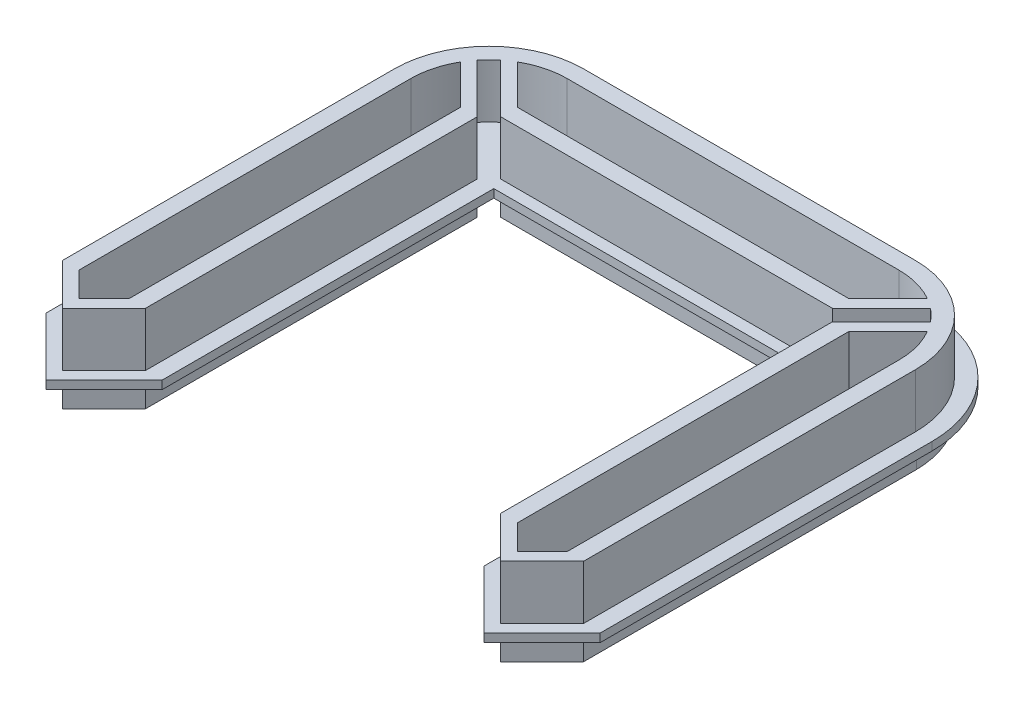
SolidWorks part; units mm, degrees
ref_plane "Alzado" through (0, 0, 0) normal (0, 0, 1) x (1, 0, 0)
ref_plane "Planta" through (0, 0, 0) normal (0, 1, 0) x (1, 0, 0)
ref_plane "Vista lateral" through (0, 0, 0) normal (1, 0, 0) x (0, 0, -1)
sketch "Croquis1" plane through (0, 0, 0) normal (0, 1, 0) x (1, 0, 0)
  line L1 (20, -5) -> (-20, -5)
  line L3 (20, 5) -> (-19.9985, 5)
  line L5 (20.8333, -4.1667) -> (-22.9964, 4.5993) construction
  line L6 (22.9972, 4.5994) -> (-20.8333, -4.1667) construction
  line L7 (25, 0) -> (20, -5)
  line L8 (-25, 0) -> (-20, -5)
  line L9 (20, -5) -> (21.4142, -6.4142) construction
  line L10 (21.4142, -6.4142) -> (21.4142, -46.4142)
  line L11 (21.4142, -46.4142) -> (26.4135, -51.4135)
  line L12 (26.4135, -51.4135) -> (31.4127, -46.4142)
  line L13 (31.4127, -46.4142) -> (31.4127, -6.4142)
  line L15 (26.4135, -1.415) -> (21.4142, -6.4142)
  line L17 (31.4127, -6.3004) -> (31.4127, -6.4142)
  line L19 (-26.4135, -1.415) -> (-21.4142, -6.4142)
  line L22 (-31.4127, -46.4142) -> (-31.4127, -6.4142)
  line L23 (-26.4135, -51.4135) -> (-31.4127, -46.4142)
  line L24 (-21.4142, -46.4142) -> (-26.4135, -51.4135)
  line L25 (-21.4142, -6.4142) -> (-21.4142, -46.4142)
  line L26 (26.4135, -1.415) -> (28.7469, 0.9185)
  line L28 (25, 0) -> (27.3328, 2.3328)
  line L30 (-25, 0) -> (-27.3322, 2.3322)
  line L32 (-26.4135, -1.415) -> (-28.7463, 0.9179)
  arc A0 (20, 5) -> (27.3328, 2.3328) centre (20, -6.4133) cw
  arc A1 (-31.4127, -6.4142) -> (-28.7463, 0.9179) centre (-19.9985, -6.4142) cw
  arc A2 (-27.3322, 2.3322) -> (-19.9985, 5) centre (-19.9985, -6.4142) cw
  arc A3 (28.7469, 0.9185) -> (31.4127, -6.3004) centre (20, -6.4133) cw
  point P0 (0, 0)
extrude "Saliente-Extruir3" add sketch "Croquis1" along normal blind 4
sketch "Croquis3" plane through (0, 4, 0) normal (0, 1, 0) x (1, 0, 0)
  line L0 (-21.4142, -6.4142) -> (-20, -5)
  line L5 (-31.4127, -6.4142) -> (-31.4127, -8.1361) construction
  line L6 (-31.4127, -6.4142) -> (-31.4127, -46.4142) construction
  line L8 (-21.4142, -6.4142) -> (-28.7463, 0.9179)
  line L9 (-20, -5) -> (-27.3322, 2.3322)
  line L12 (31.4127, -6.4142) -> (31.4127, -8.1361) construction
  line L13 (20, -5) -> (27.3322, 2.3322)
  line L14 (21.4142, -6.4142) -> (28.7463, 0.9179)
  line L15 (21.4142, -6.4142) -> (20, -5)
  arc A0 (-28.7463, 0.9179) -> (-27.3322, 2.3322) centre (-19.9985, -6.4142) cw
  arc A2 (28.7463, 0.9179) -> (27.3322, 2.3322) centre (19.9985, -6.4142) ccw
extrude "Saliente-Extruir4" add sketch "Croquis3" against normal blind 1
sketch "Croquis4" plane through (0, 4, 0) normal (0, 1, 0) x (1, 0, 0)
  line L0 (-31.4127, -46.4142) -> (-31.4127, -6.4142)
  line L1 (-21.4142, -46.4142) -> (-21.4142, -6.4142)
  line L2 (-21.4142, -6.4142) -> (-20, -5)
  line L3 (-20, -5) -> (20, -5)
  line L4 (20, -5) -> (21.4142, -6.4142)
  line L5 (21.4142, -6.4142) -> (21.4142, -46.4142)
  line L6 (21.4142, -46.4142) -> (26.4135, -51.4135)
  line L7 (26.4135, -51.4135) -> (31.4127, -46.4142)
  line L8 (31.4127, -46.4142) -> (31.4133, -6.4134)
  line L9 (20, 5) -> (-19.9985, 5)
  line L10 (-31.4127, -46.4142) -> (-33.4127, -46.4142) construction
  line L11 (-33.4127, -46.4142) -> (-33.4127, -6.4142)
  line L12 (-26.4135, -51.4135) -> (-26.4135, -53.4135) construction
  line L13 (-21.4142, -46.4142) -> (-19.4142, -46.4142) construction
  line L14 (21.4142, -46.4142) -> (19.4142, -46.4142) construction
  line L15 (26.4135, -51.4135) -> (26.4135, -53.4135) construction
  line L16 (31.4127, -46.4142) -> (33.4127, -46.4142) construction
  line L17 (-33.4127, -46.4142) -> (-26.4135, -53.4135)
  line L18 (-26.4135, -53.4135) -> (-19.4142, -46.4142)
  line L19 (-19.4142, -46.4142) -> (-19.4142, -6.4142)
  line L20 (19.4142, -46.4142) -> (26.4135, -53.4135)
  line L21 (26.4135, -53.4135) -> (33.4127, -46.4142)
  line L22 (33.4127, -46.4142) -> (33.4127, -6.4127)
  line L23 (20, 5) -> (20, 7) construction
  line L24 (20, 7) -> (-19.9985, 7)
  line L25 (19.4142, -46.4142) -> (19.4142, -6.4133)
  line L26 (19.4142, -6.4133) -> (-19.4142, -6.4142)
  arc A0 (-31.4127, -6.4142) -> (-19.9985, 5) centre (-19.9985, -6.4142) cw
  arc A1 (20, 5) -> (31.4133, -6.4134) centre (20, -6.4133) cw
  arc A2 (-33.4127, -6.4142) -> (-19.9985, 7) centre (-19.9985, -6.4142) cw
  arc A3 (20, 7) -> (33.4127, -6.4127) centre (20, -6.4127) cw
extrude "Saliente-Extruir5" add sketch "Croquis4" against normal blind 1 contours A3 L24 A2 L11 L17 L18 L19 L26 L25 L20 L21 L22 A1 L8 M1 M15 M13 M12 M11 M10 M9 M8 M7 M6 M5 M4 M3 M2
sketch "Croquis6" plane through (0, 0, 0) normal (0, -1, 0) x (-1, 0, 0)
  line L0 (22.4142, -6.4142) -> (28.4715, -0.357)
  line L1 (-20, 4) -> (20, 4)
  line L3 (-20, -4) -> (20, -4)
  line L5 (-20, 4) -> (20, -4) construction
  line L6 (-20, -4) -> (20, 4) construction
  line L7 (-21.4142, -26.4142) -> (-26.4142, -26.4142) construction
  line L8 (30.4142, -46.4142) -> (22.4142, -6.4142) construction
  line L9 (-21.4142, -6.4142) -> (-21.4142, -46.4142) construction
  line L10 (-20, -4) -> (-26.0572, 2.0572)
  line L12 (-30.4142, -6.4142) -> (-30.4142, -46.4142)
  line L14 (-22.4142, -6.4142) -> (-22.4142, -46.4142)
  line L15 (-30.4142, -6.4142) -> (-22.4142, -46.4142) construction
  line L16 (-30.4142, -46.4142) -> (-22.4142, -6.4142) construction
  line L17 (-22.4142, -6.4142) -> (-28.4715, -0.357)
  line L20 (30.4142, -6.4142) -> (22.4142, -46.4142) construction
  line L21 (21.4142, -26.4142) -> (26.4142, -26.4142) construction
  line L22 (22.4142, -6.4142) -> (22.4142, -46.4142)
  line L23 (20, -4) -> (26.0572, 2.0572)
  line L24 (30.4142, -6.4142) -> (30.4142, -46.4142)
  line L26 (30.4142, -46.4142) -> (26.4142, -50.4142)
  line L27 (26.4142, -50.4142) -> (22.4142, -46.4142)
  line L28 (-22.4142, -46.4142) -> (-26.4142, -50.4142)
  line L29 (-26.4142, -50.4142) -> (-30.4142, -46.4142)
  arc A0 (-20, 4) -> (-26.0572, 2.0572) centre (-20, -6.4142) ccw
  arc A1 (20, 4) -> (26.0572, 2.0572) centre (20, -6.4142) cw
  arc A2 (28.4715, -0.357) -> (30.4142, -6.4142) centre (20, -6.4142) cw
  arc A3 (-28.4715, -0.357) -> (-30.4142, -6.4142) centre (-20, -6.4142) ccw
  point P0 (0, 0)
extrude "Cortar-Extruir2" cut sketch "Croquis6" against normal blind 4
sketch "Croquis7" plane through (0, 0, 0) normal (0, -1, 0) x (1, 0, 0)
  line L0 (-22.4142, 6.4142) -> (-22.4142, 46.4142)
  line L1 (-22.4142, 6.4142) -> (-22.4142, 46.4142) construction
  line L2 (-22.4142, 46.4142) -> (-26.4142, 50.4142)
  line L3 (-26.4142, 50.4142) -> (-30.4142, 46.4142)
  line L4 (-30.4142, 46.4142) -> (-30.4142, 6.4142) construction
  line L5 (-26.4142, 50.4142) -> (-30.4142, 46.4142) construction
  line L6 (-30.4142, 46.4142) -> (-30.4142, 6.4142)
  line L7 (-20, 4) -> (20, 4)
  line L8 (20, 4) -> (-20, 4) construction
  line L9 (26.0572, -2.0572) -> (20, 4) construction
  line L10 (20, 4) -> (26.0572, -2.0572)
  line L11 (-20, 4) -> (-26.0572, -2.0572)
  line L12 (22.4142, 6.4142) -> (22.4142, 46.4142)
  line L13 (22.4142, 46.4142) -> (26.4142, 50.4142)
  line L14 (26.4142, 50.4142) -> (30.4142, 46.4142)
  line L15 (30.4142, 46.4142) -> (30.4142, 6.4142)
  line L16 (22.4142, 6.4142) -> (28.4715, 0.357)
  line L17 (-20, -4) -> (20, -4)
  line L18 (-22.4142, 6.4142) -> (-28.4715, 0.357)
  arc A0 (-30.4142, 6.4142) -> (-28.4715, 0.357) centre (-20, 6.4142) ccw
  arc A1 (30.4142, 6.4142) -> (28.4715, 0.357) centre (20, 6.4142) cw
  arc A2 (-26.0572, -2.0572) -> (-20, -4) centre (-20, 6.4142) ccw
  arc A3 (26.0572, -2.0572) -> (20, -4) centre (20, 6.4142) cw
extrude "Saliente-Extruir6" add sketch "Croquis7" against normal blind 1
sketch "Croquis8" plane through (0, 4, 0) normal (0, 1, 0) x (1, 0, 0)
  line L2 (-23.4142, -6.4142) -> (-23.4142, -46.4142)
  line L4 (-21.4142, -46.4142) -> (-21.4142, -6.4142)
  line L5 (-23.4142, -6.4142) -> (-28.1414, -1.6871)
  line L6 (-21.4142, -6.4142) -> (-27.3263, -0.5021)
  line L8 (-23.4142, -46.4142) -> (-26.4142, -49.4142)
  line L9 (-29.5956, -0.2329) -> (-29.5996, -0.2289)
  line L10 (-26.4142, -51.4142) -> (-21.4142, -46.4142)
  line L13 (-31.4142, -46.4142) -> (-26.4142, -51.4142)
  line L14 (-29.4142, -46.4142) -> (-26.4142, -49.4142)
  line L15 (-29.4142, -46.4142) -> (-29.4142, -6.4142)
  line L17 (-31.4142, -6.4142) -> (-31.4142, -46.4142)
  line L20 (-20, -5) -> (20, -5)
  line L22 (20, -3) -> (-20, -3)
  line L23 (-20, -5) -> (-25.9121, 0.9121)
  line L24 (-20, -3) -> (-24.7271, 1.7271)
  line L25 (20, -3) -> (24.7271, 1.7271)
  line L26 (20, -5) -> (25.9121, 0.9121)
  line L27 (29.5956, -0.2329) -> (29.5996, -0.2289)
  line L29 (-20, 4) -> (20, 4) construction
  line L30 (20, 3) -> (-20, 3)
  line L32 (20, 5) -> (-20, 5)
  line L36 (29.4142, -46.4142) -> (26.4142, -49.4142)
  line L37 (31.4142, -46.4142) -> (26.4142, -51.4142)
  line L38 (26.4142, -51.4142) -> (21.4142, -46.4142)
  line L39 (23.4142, -46.4142) -> (26.4142, -49.4142)
  line L40 (21.4142, -6.4142) -> (27.3263, -0.5021)
  line L41 (23.4142, -6.4142) -> (28.1414, -1.6871)
  line L42 (21.4142, -46.4142) -> (21.4142, -6.4142)
  line L43 (23.4142, -6.4142) -> (23.4142, -46.4142)
  line L44 (31.4142, -6.4142) -> (31.4142, -46.4142)
  line L45 (29.4142, -46.4142) -> (29.4142, -6.4142)
  arc A0 (-29.4142, -6.4142) -> (-28.1414, -1.6871) centre (-20, -6.4142) cw
  arc A1 (-31.4142, -6.4142) -> (-20, 5) centre (-20, -6.4142) cw
  arc A2 (29.4142, -6.4142) -> (28.1414, -1.6871) centre (20, -6.4142) ccw
  arc A3 (20, 5) -> (31.4142, -6.4142) centre (20, -6.4142) cw
  arc A4 (27.3263, -0.5021) -> (25.9121, 0.9121) centre (20, -6.4142) ccw
  arc A5 (24.7271, 1.7271) -> (20, 3) centre (20, -6.4142) ccw
  arc A6 (-27.3263, -0.5021) -> (-25.9121, 0.9121) centre (-20, -6.4142) cw
  arc A7 (-24.7271, 1.7271) -> (-20, 3) centre (-20, -6.4142) cw
  point P35 (0, 4)
extrude "Saliente-Extruir7" add sketch "Croquis8" along normal blind 6.5 contours L6 A6 L23 L20 L26 A4 L40 L42 L38 L37 L44 A3 L32 A1 L17 L13 L10 L4 M34 M29 M30 M31 M32 M33 M40 M35 M36 M37 M38 M39 M46 M41 M42 M43 M44 M45 M49 M47 M48 M53 M50 M51 M52 | L24 A7 L30 A5 L25 L22 M41 M46 M45 M44 M43 M42 | A2 L45 L36 L39 L43 L41 M35 M40 M39 M38 M37 M36 | L15 A0 L5 L2 L8 L14 M29 M34 M33 M32 M31 M30
